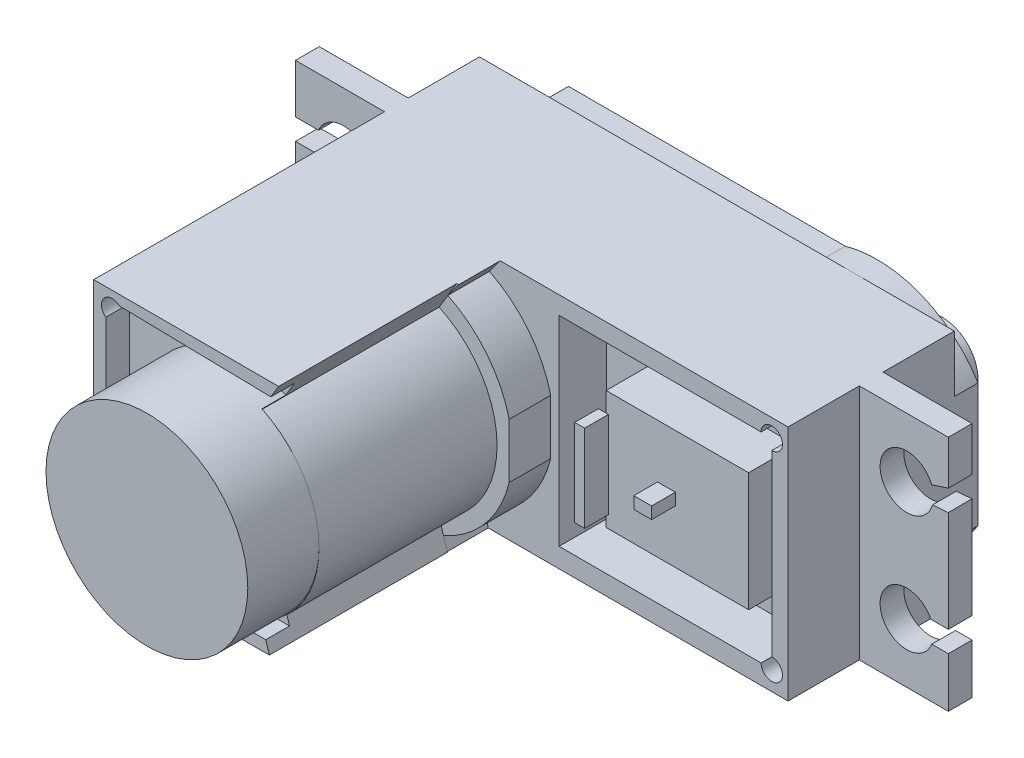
SolidWorks part; units mm, degrees
ref_plane "Front Plane" through (0, 0, 0) normal (0, 0, 1) x (1, 0, 0)
ref_plane "Top Plane" through (0, 0, 0) normal (0, 1, 0) x (1, 0, 0)
ref_plane "Right Plane" through (0, 0, 0) normal (1, 0, 0) x (0, 0, -1)
sketch "Sketch1" plane through (0, 0, 0) normal (0, 1, 0) x (1, 0, 0)
  line L0 (28.7395, 3.6134) -> (36.2395, 3.6134)
  line L1 (-11.2605, 13.6134) -> (28.7395, 13.6134)
  line L2 (-11.2605, 13.6134) -> (-11.2605, 5.6134)
  line L3 (-11.2605, -26.8866) -> (28.7395, -26.8866)
  line L4 (28.7395, 13.6134) -> (28.7395, 5.6134)
  line L5 (-18.7605, 3.6134) -> (-18.7605, 5.6134)
  line L6 (-11.2605, 3.6134) -> (-18.7605, 3.6134)
  line L7 (-18.7605, 5.6134) -> (-11.2605, 5.6134)
  line L8 (8.7395, 36.2185) -> (8.7395, -42.7731) construction
  line L9 (36.2395, 3.6134) -> (36.2395, 5.6134)
  line L10 (36.2395, 5.6134) -> (28.7395, 5.6134)
  line L11 (-11.2605, 3.6134) -> (-11.2605, -26.8866)
  line L12 (28.7395, 3.6134) -> (28.7395, -26.8866)
  dimension "D1" = 40
  dimension "D2" = 40.5
  dimension "D3" = 10
  dimension "D4" = 10
  dimension "D5" = 20
  dimension "D6" = 27.5
  dimension "D7" = 27.5
  dimension "D8" = 2
  dimension "D9" = 2
extrude "Boss-Extrude1" add sketch "Sketch1" along normal blind 20
sketch "Sketch2" plane through (0, 0, -13.6134) normal (0, 0, -1) x (-1, 0, 0)
  line L0 (-36.2395, 20) -> (-36.2395, 0) construction
  line L1 (-28.7395, 20) -> (11.2605, 20) construction
  circle A0 centre (-20.2395, 10) radius 6.5232
  dimension "D1" = 16
  dimension "D2" = 10
extrude "Boss-Extrude2" add sketch "Sketch2" along normal blind 0.5
sketch "Sketch3" plane through (0, 0, -14.1134) normal (0, 0, -1) x (-1, 0, 0)
  circle A0 centre (-20.2395, 10) radius 3
  circle A1 centre (-20.2395, 10) radius 6.5232 construction
  dimension "D1" = 6
extrude "Boss-Extrude3" add sketch "Sketch3" along normal blind 5
sketch "Sketch4" plane through (0, 0, -13.6134) normal (0, 0, -1) x (-1, 0, 0)
  line L0 (11.2605, 20) -> (11.2605, 0) construction
  line L1 (-17.55, 19.6012) -> (5.7605, 19.6012)
  line L3 (-17.55, 0.3988) -> (5.7605, 0.3988)
  line L4 (5.7605, 19.6012) -> (5.7605, 12.92)
  line L5 (5.7605, 6.7267) -> (5.7605, 0.3988)
  line L7 (-36.6976, 26.1587) -> (19.6892, 26.1587)
  line L8 (-36.6976, 26.1587) -> (-36.6976, -5.6717)
  line L9 (-36.6976, -5.6717) -> (19.6892, -5.6717)
  line L10 (19.6892, 26.1587) -> (19.6892, -5.6717)
  arc A0 (5.7605, 6.7267) -> (5.7605, 12.92) centre (2.4954, 9.8233) ccw
  arc A1 (-17.55, 19.6012) -> (-17.55, 0.3988) centre (-20.2395, 10) ccw
  dimension "D1" = 9
  dimension "D2" = 5.5
extrude "Cut-Extrude2" cut sketch "Sketch4" against normal blind 2 contours L8 L7 L10 L9 | A1 L3 L5 A0 L4 L1
sketch "Sketch5" plane through (0, 0, -5.6134) normal (0, 0, -1) x (-1, 0, 0)
  line L0 (-46.3287, 10) -> (34.808, 10) construction
  line L1 (-36.2395, 20) -> (-28.7395, 20) construction
  line L2 (-28.7395, 20) -> (-28.7395, 0) construction
  line L3 (-28.7395, 0) -> (-28.7395, 4.7879) construction
  line L4 (18.7605, 20) -> (18.7605, 0) construction
  line L5 (-37.081, 14.577) -> (-34.9071, 14.3967)
  line L7 (-37.081, 14.577) -> (-37.081, 16.5615)
  line L8 (-37.081, 16.5615) -> (-34.8325, 15.8256)
  line L9 (-34.8448, 4.2062) -> (-37.1656, 4.2062)
  line L10 (-37.1656, 4.2062) -> (-37.1656, 5.9874)
  line L11 (-37.1656, 5.9874) -> (-34.767, 5.9756)
  line L12 (16.8179, 15.871) -> (19.6327, 15.871)
  line L13 (19.6327, 15.871) -> (19.6327, 14.0868)
  line L14 (19.6327, 14.0868) -> (16.7997, 14.0868)
  line L15 (16.8179, 5.9108) -> (19.8636, 5.9108)
  line L16 (19.8636, 5.9108) -> (19.8636, 4.2062)
  line L17 (19.8636, 4.2062) -> (16.9262, 4.39)
  arc A0 (-34.9071, 14.3967) -> (-34.8325, 15.8256) centre (-32.7395, 15) ccw
  arc A1 (-34.8448, 4.2062) -> (-34.767, 5.9756) centre (-32.7395, 5) ccw
  arc A2 (16.8179, 15.871) -> (16.7997, 14.0868) centre (14.7433, 15) ccw
  arc A3 (16.8179, 5.9108) -> (16.9262, 4.39) centre (14.7605, 5) ccw
  point P20 (-34.8448, 14.5868)
  point P21 (-34.6335, 16.0538)
  point P32 (19.8636, 4.2062)
  point P35 (-34.9474, 15.871)
  point P36 (-34.8325, 14.4175)
  point P37 (-34.8448, 6.0131)
  dimension "D1" = 4.5
  dimension "D2" = 4.5
  dimension "D3" = 4.5
  dimension "D4" = 4.5
  dimension "D5" = 10
  dimension "D6" = 5
  dimension "D7" = 5
  dimension "D8" = 5
  dimension "D9" = 5
  dimension "D10" = 4
  dimension "D11" = 4
  dimension "D12" = 4.0172
  dimension "D13" = 4
extrude "Cut-Extrude3" cut sketch "Sketch5" against normal blind 12
sketch "Sketch6" plane through (0, 0, 0) normal (0, -1, 0) x (1, 0, 0)
  line L0 (-11.2605, -11.6134) -> (28.7395, -11.6134) construction
  line L1 (8.7395, 31.7025) -> (28.7395, 31.7025)
  line L2 (8.7395, 31.7025) -> (8.7395, 2.3866)
  line L3 (8.7395, 2.3866) -> (28.7395, 2.3866)
  line L4 (28.7395, 31.7025) -> (28.7395, 2.3866)
  line L5 (28.7395, -3.6134) -> (36.2395, -3.6134) construction
  line L6 (28.7395, 26.8866) -> (28.7395, -3.6134) construction
  point P8 (28.7395, 2.3866)
  point P10 (37.7887, 8.9139)
  dimension "D1" = 14
  dimension "D2" = 6
  dimension "D3" = 20
extrude "Cut-Extrude4" cut sketch "Sketch6" against normal blind 22
sketch "Sketch7" plane through (0, 0, 2.3866) normal (0, 0, 1) x (1, 0, 0)
  line L0 (8.7395, 0) -> (28.7395, 0) construction
  line L1 (13.4145, 15) -> (25.4145, 15)
  line L2 (13.4145, 15) -> (13.4145, 5)
  line L3 (13.4145, 5) -> (25.4145, 5)
  line L4 (25.4145, 15) -> (25.4145, 5)
  line L6 (9.4491, 18.4974) -> (27.3658, 18.4974)
  line L7 (9.4491, 18.4974) -> (9.4491, 1.645)
  line L8 (9.4491, 1.645) -> (27.3658, 1.645)
  line L9 (27.3658, 18.4974) -> (27.3658, 1.645)
  dimension "D1" = 10
  dimension "D2" = 5
  dimension "D3" = 12
extrude "Cut-Extrude5" cut sketch "Sketch7" against normal blind 4
sketch "Sketch8" plane through (0, 0, 2.3866) normal (0, 0, 1) x (1, 0, 0)
  line L0 (28.7395, 20) -> (28.7395, 0) construction
  line L1 (17.7395, 10.4884) -> (19.2395, 10.4884)
  line L2 (17.7395, 10.4884) -> (17.7395, 9.4884)
  line L3 (17.7395, 9.4884) -> (19.2395, 9.4884)
  line L4 (19.2395, 10.4884) -> (19.2395, 9.4884)
  line L6 (13.6019, 13.3464) -> (12.7603, 13.3464)
  line L7 (13.6019, 13.3464) -> (13.6019, 6.0299)
  line L8 (13.6019, 6.0299) -> (12.7603, 6.0299)
  line L9 (12.7603, 13.3464) -> (12.7603, 6.0299)
  dimension "D1" = 11
  dimension "D2" = 1.5
  dimension "D3" = 1
extrude "Boss-Extrude4" add sketch "Sketch8" along normal blind 2
sketch "Sketch9" plane through (0, 0, 26.8866) normal (0, 0, 1) x (1, 0, 0)
  line L0 (-11.2605, 0) -> (8.7395, 0) construction
  line L2 (-15.2441, 26.9539) -> (17.5382, 26.9539)
  line L3 (-15.2441, 26.9539) -> (-15.2441, -10.1568)
  line L4 (-15.2441, -10.1568) -> (17.5382, -10.1568)
  line L5 (17.5382, 26.9539) -> (17.5382, -10.1568)
  circle A0 centre (-0.7806, 10) radius 8.5
  dimension "D2" = 17
  dimension "D1" = 10
extrude "Cut-Extrude6" cut sketch "Sketch9" against normal blind 6
sketch "Sketch10" plane through (0, 0, 20.8866) normal (0, 0, 1) x (1, 0, 0)
  line L0 (6.6699, 23.9048) -> (2.8419, 17.5433)
  line L1 (6.6699, 23.9048) -> (11.5778, 23.1361)
  line L2 (11.5778, 23.1361) -> (11.5778, -3.946)
  line L3 (11.5778, -3.946) -> (4.7559, -3.946)
  line L4 (4.7559, -3.946) -> (2.8419, 2.2381)
  arc A0 (2.8419, 2.2381) -> (2.8419, 17.5433) centre (-0.7215, 9.8907) ccw
extrude "Cut-Extrude7" cut sketch "Sketch10" against normal blind 15
sketch "Sketch11" plane through (0, 0, 5.8866) normal (0, 0, 1) x (1, 0, 0)
  line L0 (3.5811, 18.7716) -> (7.4386, 24.0249)
  line L1 (4.3202, 20) -> (2.8419, 17.5433) construction
  line L2 (7.4386, 24.0249) -> (11.7223, 23.5108)
  line L3 (11.7223, 23.5108) -> (11.7223, -4.5355)
  line L4 (11.7223, -4.5355) -> (4.6594, -4.5355)
  line L5 (4.6594, -4.5355) -> (3.2058, 1.0516)
  arc A3 (3.2058, 1.0516) -> (3.5811, 18.7716) centre (-0.7806, 10) ccw
  point P3 (3.1883, 1.1191)
extrude "Cut-Extrude8" cut sketch "Sketch11" against normal blind 3.5
sketch "Sketch12" plane through (0, 0, 20.8866) normal (0, 0, 1) x (1, 0, 0)
  line L0 (-10.2416, 19.1895) -> (7.2612, 18.8347)
  line L1 (7.2612, 18.8347) -> (5.5797, 15.6388)
  line L2 (-10.2416, 19.1895) -> (-10.2416, 0.9771)
  line L3 (-10.2416, 0.9771) -> (6.3151, 0.9771)
  line L4 (6.3151, 0.9771) -> (4.4737, 3.3186)
  arc A0 (5.5797, 15.6388) -> (4.4737, 3.3186) centre (-0.7806, 10) ccw
extrude "Cut-Extrude9" cut sketch "Sketch12" against normal blind 2
sketch "Sketch13" plane through (0, 0, 26.8866) normal (0, 0, 1) x (1, 0, 0)
  circle A0 centre (27.3658, 18.4974) radius 0.9
  circle A1 centre (27.3658, 1.645) radius 0.9
  circle A2 centre (-9.7094, 18.4974) radius 0.9
  circle A3 centre (-9.7094, 1.645) radius 0.9
  dimension "D1" = 1.8
  dimension "D2" = 1.8
  dimension "D3" = 1.8
  dimension "D4" = 1.8
extrude "Cut-Extrude10" cut sketch "Sketch13" against normal blind 35
